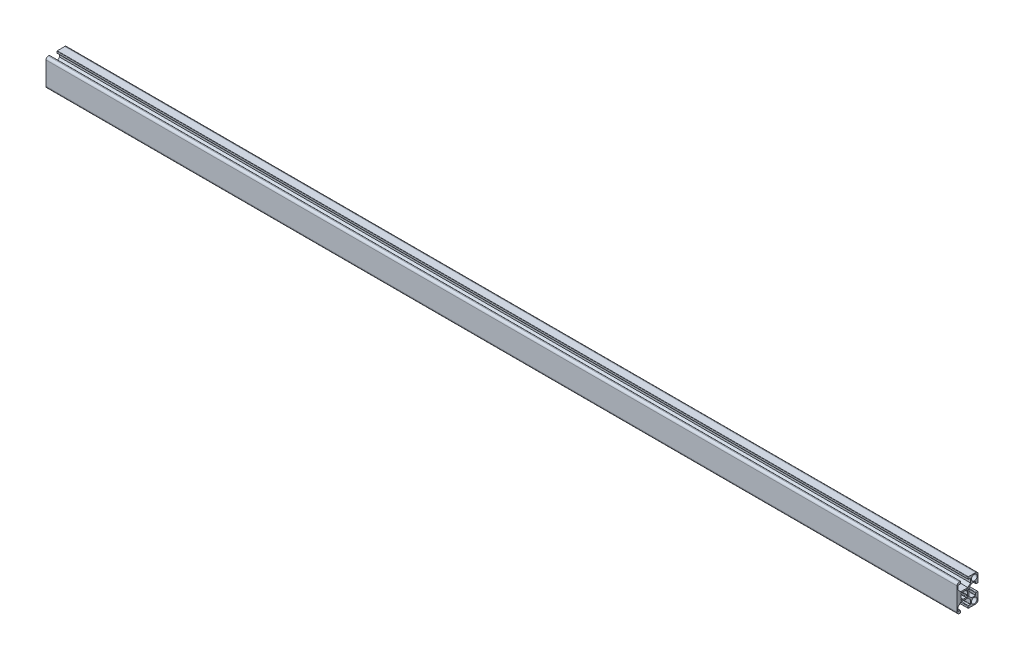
SolidWorks part; units mm, degrees
ref_plane "Front Plane" through (0, 0, 0) normal (0, 0, 1) x (1, 0, 0)
ref_plane "Top Plane" through (0, 0, 0) normal (0, 1, 0) x (1, 0, 0)
ref_plane "Right Plane" through (0, 0, 0) normal (1, 0, 0) x (0, 0, -1)
sketch "Sketch1" plane through (0, 0, 0) normal (0, 0, 1) x (1, 0, 0)
  line L0 (0, 0) -> (1000, 0)
  dimension "D1" = 1000
other "30-sarja 1.0004 23X30(1)"
ref_plane "Plane1" through (0, 0, 0) normal (1, 0, 0) x (0, 0, -1)
sketch "Model4" plane through (0, 0, 0) normal (1, 0, 0) x (0, 0, -1)
  line L0 (-3.3633, -1.9491) -> (-3.6573, -2.2431)
  line L1 (-3.6573, -2.2431) -> (-3.8789, -3.2859)
  line L2 (-3.2859, -3.8789) -> (-2.2431, -3.6573)
  line L3 (-2.2431, -3.6573) -> (-1.9491, -3.3633)
  line L4 (1.9491, -3.3633) -> (2.2431, -3.6573)
  line L5 (2.2431, -3.6573) -> (3.2859, -3.8789)
  line L6 (3.8789, -3.2859) -> (3.6573, -2.2431)
  line L7 (3.6573, -2.2431) -> (3.3633, -1.9491)
  line L8 (3.3633, 1.9491) -> (3.6573, 2.2431)
  line L9 (3.6573, 2.2431) -> (3.8789, 3.2859)
  line L10 (3.2859, 3.8789) -> (2.2431, 3.6573)
  line L11 (2.2431, 3.6573) -> (1.9491, 3.3633)
  line L12 (-1.9491, 3.3633) -> (-2.2431, 3.6573)
  line L13 (-2.2431, 3.6573) -> (-3.2859, 3.8789)
  line L14 (-3.8789, 3.2859) -> (-3.6573, 2.2431)
  line L15 (-3.6573, 2.2431) -> (-3.3633, 1.9491)
  line L16 (4.1, 14.7) -> (4.1, 13)
  line L17 (12.5, 15) -> (4.4, 15)
  line L18 (15, 4.4) -> (15, 12.5)
  line L19 (13, 4.1) -> (14.7, 4.1)
  line L20 (12.5, 6.5) -> (12.5, 4.6)
  line L21 (7.8607, 6.8) -> (12.2, 6.8)
  line L22 (5, 3.9393) -> (7.8607, 6.8)
  line L23 (5, -3.9393) -> (5, 3.9393)
  line L24 (7.8607, -6.8) -> (5, -3.9393)
  line L25 (12.2, -6.8) -> (7.8607, -6.8)
  line L26 (12.5, -4.6) -> (12.5, -6.5)
  line L27 (14.7, -4.1) -> (13, -4.1)
  line L28 (15, -12.5) -> (15, -4.4)
  line L29 (4.4, -15) -> (12.5, -15)
  line L30 (4.1, -13) -> (4.1, -14.7)
  line L31 (6.5, -12.5) -> (4.6, -12.5)
  line L32 (6.8, -7.8607) -> (6.8, -12.2)
  line L33 (3.9393, -5) -> (6.8, -7.8607)
  line L34 (-3.9393, -5) -> (3.9393, -5)
  line L35 (-6.8, -7.8607) -> (-3.9393, -5)
  line L36 (-6.8, -12.2) -> (-6.8, -7.8607)
  line L37 (-4.6, -12.5) -> (-6.5, -12.5)
  line L38 (-4.1, -14.7) -> (-4.1, -13)
  line L39 (-5.5, -15) -> (-4.4, -15)
  line L40 (-8, 12.5) -> (-8, -12.5)
  line L41 (-4.4, 15) -> (-5.5, 15)
  line L42 (-4.1, 13) -> (-4.1, 14.7)
  line L43 (-6.5, 12.5) -> (-4.6, 12.5)
  line L44 (-6.8, 7.8607) -> (-6.8, 12.2)
  line L45 (-3.9393, 5) -> (-6.8, 7.8607)
  line L46 (3.9393, 5) -> (-3.9393, 5)
  line L47 (6.8, 7.8607) -> (3.9393, 5)
  line L48 (6.8, 12.2) -> (6.8, 7.8607)
  line L49 (4.6, 12.5) -> (6.5, 12.5)
  circle A0 centre (10.9, 10.9) radius 3.1
  arc A1 (-3.8789, -3.2859) -> (-3.2859, -3.8789) centre (-3.3898, -3.3898) ccw
  arc A2 (-1.6059, -3.3056) -> (-1.9491, -3.3633) centre (-1.7369, -3.5754) ccw
  arc A3 (-1.6059, -3.3056) -> (1.6059, -3.3056) centre (0, 0) ccw
  arc A4 (1.9491, -3.3633) -> (1.6059, -3.3056) centre (1.7369, -3.5754) ccw
  arc A5 (3.2859, -3.8789) -> (3.8789, -3.2859) centre (3.3898, -3.3898) ccw
  arc A6 (3.3056, -1.6059) -> (3.3633, -1.9491) centre (3.5754, -1.7369) ccw
  arc A7 (3.3056, -1.6059) -> (3.3056, 1.6059) centre (0, 0) ccw
  arc A8 (3.3633, 1.9491) -> (3.3056, 1.6059) centre (3.5754, 1.7369) ccw
  arc A9 (3.8789, 3.2859) -> (3.2859, 3.8789) centre (3.3898, 3.3898) ccw
  arc A10 (1.6059, 3.3056) -> (1.9491, 3.3633) centre (1.7369, 3.5754) ccw
  arc A11 (1.6059, 3.3056) -> (-1.6059, 3.3056) centre (0, 0) ccw
  arc A12 (-1.9491, 3.3633) -> (-1.6059, 3.3056) centre (-1.7369, 3.5754) ccw
  arc A13 (-3.2859, 3.8789) -> (-3.8789, 3.2859) centre (-3.3898, 3.3898) ccw
  arc A14 (-3.3056, 1.6059) -> (-3.3633, 1.9491) centre (-3.5754, 1.7369) ccw
  arc A15 (-3.3056, 1.6059) -> (-3.3056, -1.6059) centre (0, 0) ccw
  arc A16 (-3.3633, -1.9491) -> (-3.3056, -1.6059) centre (-3.5754, -1.7369) ccw
  arc A17 (4.4, 15) -> (4.1, 14.7) centre (4.4, 14.7) ccw
  arc A18 (15, 12.5) -> (12.5, 15) centre (12.5, 12.5) ccw
  arc A19 (14.7, 4.1) -> (15, 4.4) centre (14.7, 4.4) ccw
  arc A20 (12.5, 4.6) -> (13, 4.1) centre (13, 4.6) ccw
  arc A21 (12.5, 6.5) -> (12.2, 6.8) centre (12.2, 6.5) ccw
  arc A22 (12.2, -6.8) -> (12.5, -6.5) centre (12.2, -6.5) ccw
  arc A23 (13, -4.1) -> (12.5, -4.6) centre (13, -4.6) ccw
  arc A24 (15, -4.4) -> (14.7, -4.1) centre (14.7, -4.4) ccw
  arc A25 (12.5, -15) -> (15, -12.5) centre (12.5, -12.5) ccw
  arc A26 (4.1, -14.7) -> (4.4, -15) centre (4.4, -14.7) ccw
  arc A27 (4.6, -12.5) -> (4.1, -13) centre (4.6, -13) ccw
  arc A28 (6.5, -12.5) -> (6.8, -12.2) centre (6.5, -12.2) ccw
  arc A29 (-6.8, -12.2) -> (-6.5, -12.5) centre (-6.5, -12.2) ccw
  arc A30 (-4.1, -13) -> (-4.6, -12.5) centre (-4.6, -13) ccw
  arc A31 (-4.4, -15) -> (-4.1, -14.7) centre (-4.4, -14.7) ccw
  arc A32 (-8, -12.5) -> (-5.5, -15) centre (-5.5, -12.5) ccw
  arc A33 (-5.5, 15) -> (-8, 12.5) centre (-5.5, 12.5) ccw
  arc A34 (-4.1, 14.7) -> (-4.4, 15) centre (-4.4, 14.7) ccw
  arc A35 (-4.6, 12.5) -> (-4.1, 13) centre (-4.6, 13) ccw
  arc A36 (-6.5, 12.5) -> (-6.8, 12.2) centre (-6.5, 12.2) ccw
  arc A37 (6.8, 12.2) -> (6.5, 12.5) centre (6.5, 12.2) ccw
  arc A38 (4.1, 13) -> (4.6, 12.5) centre (4.6, 13) ccw
  circle A39 centre (10.9, -10.9) radius 3.1
  point P127 (-8, 0)
  point P128 (0, 0)
  point P129 (-8, 15)
  point P130 (15, 15)
  point P131 (15, -15)
  point P132 (-8, -15)
  point P133 (0, 0)
